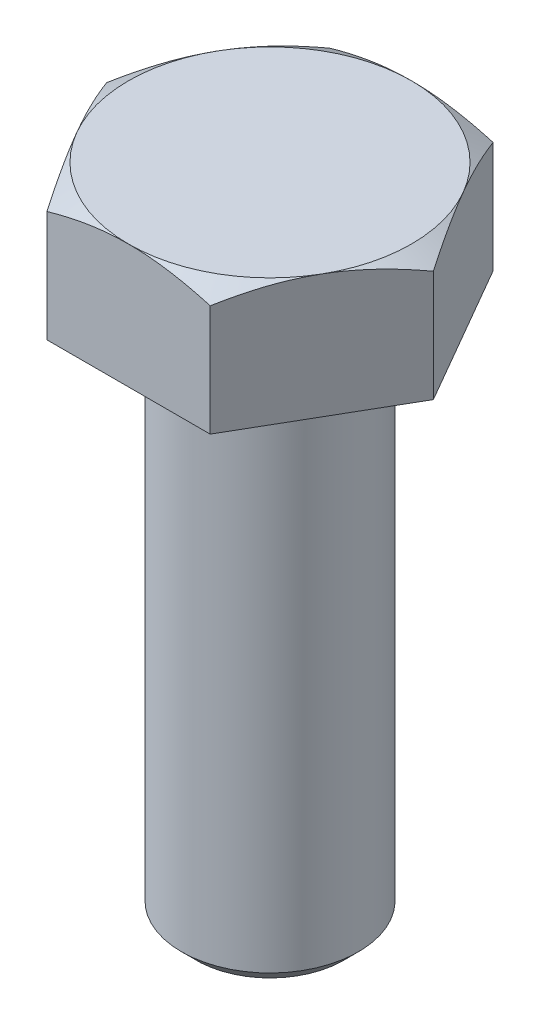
SolidWorks part; units mm, degrees
ref_plane "Front" through (0, 0, 0) normal (0, 0, 1) x (1, 0, 0)
ref_plane "Top" through (0, 0, 0) normal (0, 1, 0) x (1, 0, 0)
ref_plane "Right" through (0, 0, 0) normal (1, 0, 0) x (0, 0, -1)
sketch "Sketch1" plane through (0, 0, 0) normal (0, 1, 0) x (1, 0, 0)
  line L1 (5.5426, 0) -> (2.7713, 4.8)
  line L2 (2.7713, 4.8) -> (-2.7713, 4.8)
  line L3 (-2.7713, 4.8) -> (-5.5426, 0)
  line L4 (-5.5426, 0) -> (-2.7713, -4.8)
  line L5 (-2.7713, -4.8) -> (2.7713, -4.8)
  line L6 (2.7713, -4.8) -> (5.5426, 0)
  circle A0 centre (0, 0) radius 4.8 construction
  dimension "D1" = 9.6
extrude "Boss-Extrude1" add sketch "Sketch1" along normal blind 4.2
sketch "Sketch2" plane through (0, 4.2, 0) normal (0, 1, 0) x (1, 0, 0)
  line L0 (2.7713, -4.8) -> (5.5426, 0) construction
  circle A0 centre (0, 0) radius 4.8
extrude "Cut-Extrude1" cut sketch "Sketch2" against normal blind 7 draft 60 flip side to cut contours A0
sketch "Sketch3" plane through (0, 0, 0) normal (0, -1, 0) x (1, 0, 0)
  circle A0 centre (0, 0) radius 3
  dimension "D1" = 6
extrude "Boss-Extrude2" add sketch "Sketch3" along normal blind 18
sketch "Sketch4" plane through (0, -18, 0) normal (0, -1, 0) x (1, 0, 0)
  circle A0 centre (0, 0) radius 2.5
  dimension "D1" = 5
extrude "Cut-Extrude2" cut sketch "Sketch4" against normal blind 10 draft 45 flip side to cut
